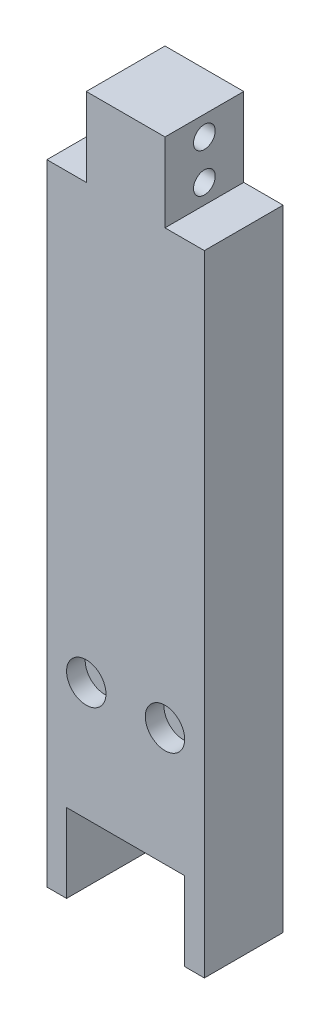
SolidWorks part; units mm, degrees
ref_plane "Front Plane" through (0, 0, 0) normal (0, 0, 1) x (1, 0, 0)
ref_plane "Top Plane" through (0, 0, 0) normal (0, 1, 0) x (1, 0, 0)
ref_plane "Right Plane" through (0, 0, 0) normal (1, 0, 0) x (0, 0, -1)
sketch "Sketch1" plane through (0, 0, 0) normal (0, 0, 1) x (1, 0, 0)
  line L0 (-6.35, 38.1) -> (-6.35, 25.4)
  line L1 (6.35, 38.1) -> (-6.35, 38.1)
  line L2 (12.7, 25.4) -> (12.7, -76.2)
  line L3 (12.7, -76.2) -> (-12.7, -76.2)
  line L4 (-12.7, 25.4) -> (-12.7, -76.2)
  line L7 (-6.35, 25.4) -> (-12.7, 25.4)
  line L8 (6.35, 38.1) -> (6.35, 25.4)
  line L9 (6.35, 25.4) -> (12.7, 25.4)
extrude "Boss-Extrude1" add sketch "Sketch1" along normal blind 12.7
sketch "Sketch2" plane through (6.35, 0, 0) normal (1, 0, 0) x (0, 0, -1)
  line L0 (-6.35, 38.1) -> (-6.35, 25.4) construction
  line L1 (-12.7, 38.1) -> (0, 38.1) construction
  line L2 (-12.7, 25.4) -> (0, 25.4) construction
  line L3 (-12.7, 31.75) -> (0, 25.4) construction
  line L4 (-12.7, 25.4) -> (-12.7, 38.1) construction
  line L5 (-12.7, 31.75) -> (0, 38.1) construction
  circle A0 centre (-6.35, 34.9242) radius 1.7526
  circle A1 centre (-6.35, 28.575) radius 1.7526
extrude "Cut-Extrude1" cut sketch "Sketch2" against normal blind 12.7
sketch "Sketch3" plane through (0, -76.2, 0) normal (0, -1, 0) x (-1, 0, 0)
  line L0 (12.7, 0) -> (9.525, 0) construction
  line L2 (12.7, 0) -> (-12.7, 0) construction
  line L3 (9.525, 0) -> (0, -12.7) construction
  line L4 (12.7, -12.7) -> (-12.7, -12.7) construction
  line L5 (0, -12.7) -> (-9.525, 0) construction
  line L6 (-9.525, 0) -> (-12.7, 0) construction
  circle A0 centre (4.7625, -6.35) radius 3.175
  circle A1 centre (-4.7625, -6.35) radius 3.175
extrude "Cut-Extrude2" cut sketch "Sketch3" against normal blind 15.7
sketch "Sketch5" plane through (0, -76.2, 0) normal (0, -1, 0) x (1, 0, 0)
  line L0 (-12.7, 12.7) -> (12.7, 12.7) construction
  line L1 (-9.525, 12.7) -> (9.525, 12.7)
  line L2 (-9.525, 12.7) -> (-9.525, 0)
  line L3 (-9.525, 0) -> (9.525, 0)
  line L4 (9.525, 12.7) -> (9.525, 0)
  line L5 (-12.7, 0) -> (12.7, 0) construction
  line L6 (-12.7, 12.7) -> (-9.525, 12.7) construction
extrude "Cut-Extrude3" cut sketch "Sketch5" against normal blind 12.7
sketch "Sketch6" plane through (0, 0, 12.7) normal (0, 0, 1) x (1, 0, 0)
  line L0 (-9.525, -63.5) -> (-12.7, -63.5) construction
  line L1 (-12.7, 25.4) -> (-12.7, -76.2) construction
  line L2 (-12.7, -63.5) -> (-12.7, -38.1) construction
  line L3 (-12.7, -38.1) -> (12.7, -38.1) construction
  line L4 (12.7, -76.2) -> (12.7, 25.4) construction
  line L5 (12.7, -38.1) -> (0, -50.8) construction
  line L6 (0, -50.8) -> (-12.7, -38.1) construction
  line L7 (-12.7, -63.5) -> (-12.7, -38.1) construction
  line L8 (-12.7, -50.8) -> (12.7, -50.8) construction
  circle A0 centre (-6.35, -44.45) radius 3.175
  circle A1 centre (6.35, -44.45) radius 3.175
extrude "Cut-Extrude4" cut sketch "Sketch6" against normal blind 3
